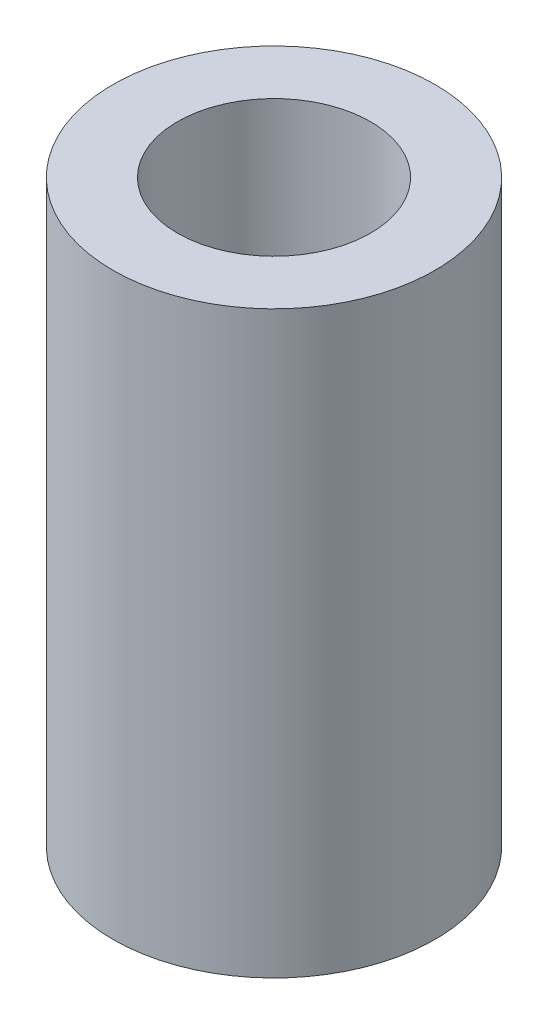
SolidWorks part; units mm, degrees
ref_plane "Plano frontal" through (0, 0, 0) normal (0, 0, 1) x (1, 0, 0)
ref_plane "Plano superior" through (0, 0, 0) normal (0, 1, 0) x (1, 0, 0)
ref_plane "Plano direito" through (0, 0, 0) normal (1, 0, 0) x (0, 0, -1)
sketch "Esboço1" plane through (0, 0, 0) normal (0, 1, 0) x (1, 0, 0)
  circle A0 centre (0, 0) radius 5
  dimension "D1" = 10
extrude "Ressalto-extrusão1" add sketch "Esboço1" along normal blind 3
sketch "Esboço2" plane through (0, 3, 0) normal (0, 1, 0) x (1, 0, 0)
  circle A0 centre (0, 0) radius 5
  circle A1 centre (0, 0) radius 3
  circle A2 centre (0, 0) radius 5 construction
  dimension "D1" = 6
extrude "Ressalto-extrusão2" add sketch "Esboço2" along normal blind 15
hole_wizard "Furo com folga de M2.51" positions "3DSketch1" profile "Esboço3" hole size "M2.5" standard "ISO"
sketch3d "3DSketch1"
  point P0 (0, 0, 0)
  point P3 (0, 0, 0)
  point P6 (0, 0, 0)
sketch "Esboço3" plane through (0, 0, 0) normal (1, 0, 0) x (0, 0, -1)
  line L0 (0, 0) -> (0, 4.8712)
  line L1 (0, 4.8712) -> (1.45, 4)
  line L2 (1.45, 4) -> (1.45, 0)
  line L5 (1.45, 0) -> (0, 0)
  line L10 (0, 4.8712) -> (-1.45, 4) construction
  line L11 (0, -6.35) -> (0, 107.95) construction
  dimension "Hole Dia." = 2.9
  dimension "Hole Depth" = 4
  dimension "Drill Angle" = 118
